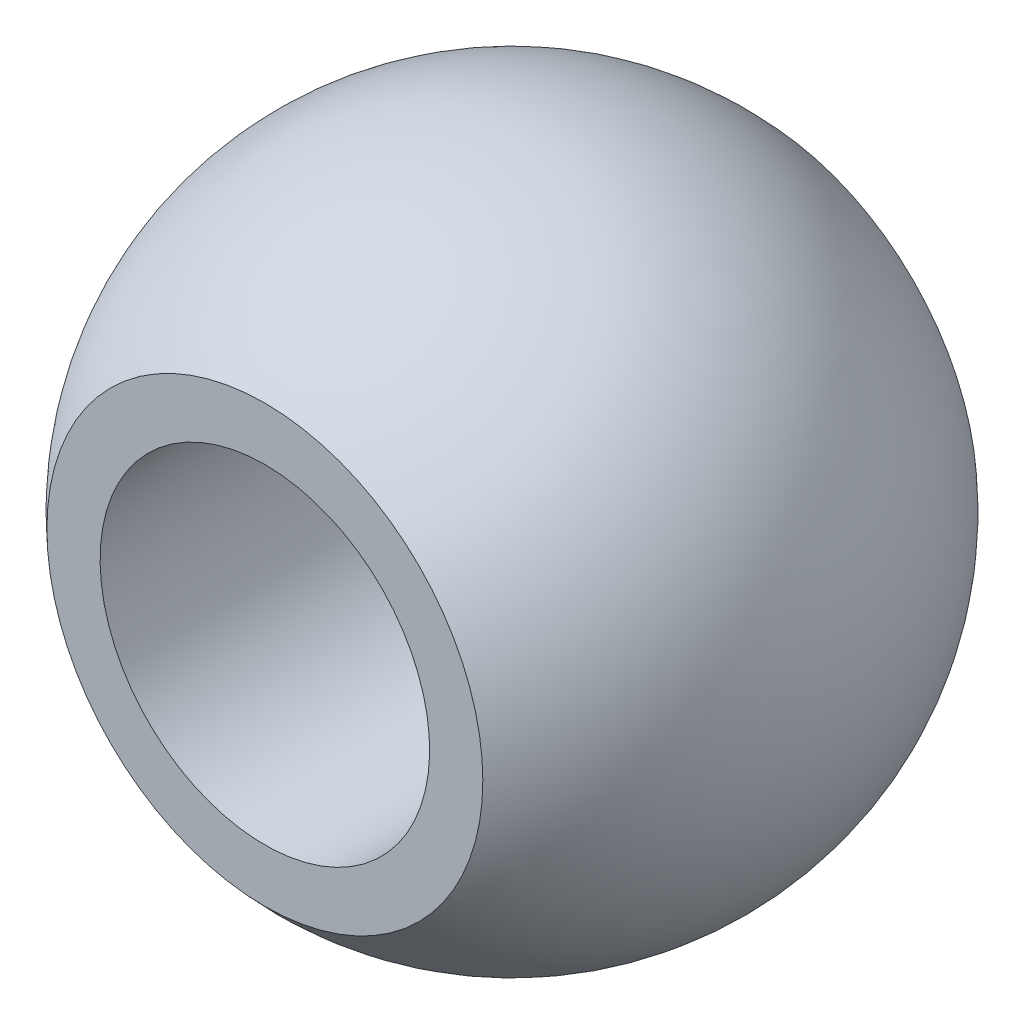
SolidWorks part; units mm, degrees
ref_plane "Plane1" through (0, 0, 0) normal (0, 0, 1) x (1, 0, 0)
ref_plane "Plane2" through (0, 0, 0) normal (0, 1, 0) x (1, 0, 0)
ref_plane "Plane3" through (0, 0, 0) normal (1, 0, 0) x (0, 0, -1)
sketch "Sketch1" plane through (0, 0, 0) normal (0, 0, 1) x (1, 0, 0)
  line L0 (0, 50.8) -> (0, -50.8) construction
  line L1 (0, 6.35) -> (0, -6.35)
  arc A0 (0, -6.35) -> (0, 6.35) centre (0, 0) ccw
  dimension "D1" = 12.7
revolve "Base-Revolve" add sketch "Sketch1" angle 360 about L0
sketch "Sketch2" plane through (0, 0, 0) normal (0, 0, 1) x (1, 0, 0)
  circle A0 centre (0, 0) radius 3.175
  dimension "D1" = 6.35
extrude "Cut-Extrude1" cut sketch "Sketch2" against normal through all and the other way through all
sketch "Sketch3" plane through (0, 0, 0) normal (1, 0, 0) x (0, 0, -1)
  line L0 (0, 1.4814) -> (0, -19.0158) construction
  line L1 (-4.7625, 15.2066) -> (-4.7625, -16.9601)
  line L2 (-4.7625, -16.9601) -> (-11.5949, -16.9601)
  line L3 (-11.5949, -16.9601) -> (-11.5949, 15.2066)
  line L4 (-11.5949, 15.2066) -> (-4.7625, 15.2066)
  line L5 (0, 50.8) -> (0, -50.8) construction
  line L6 (11.5949, 15.2066) -> (4.7625, 15.2066)
  line L7 (11.5949, -16.9601) -> (11.5949, 15.2066)
  line L8 (4.7625, -16.9601) -> (11.5949, -16.9601)
  line L9 (4.7625, 15.2066) -> (4.7625, -16.9601)
  dimension "D1" = 4.7625
extrude "Cut-Extrude2" cut sketch "Sketch3" against normal through all and the other way through all
